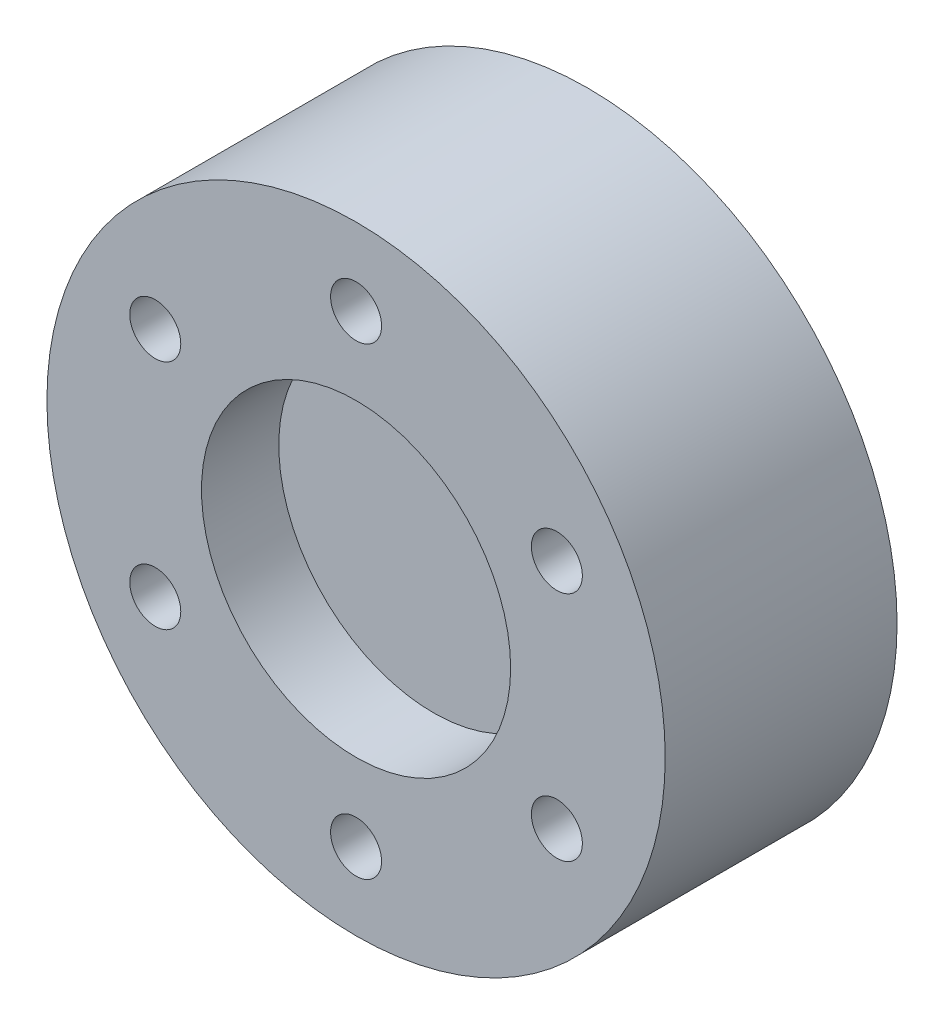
SolidWorks part; units mm, degrees
ref_plane "Front Plane" through (0, 0, 0) normal (0, 0, 1) x (1, 0, 0)
ref_plane "Top Plane" through (0, 0, 0) normal (0, 1, 0) x (1, 0, 0)
ref_plane "Right Plane" through (0, 0, 0) normal (1, 0, 0) x (0, 0, -1)
sketch "Sketch1" plane through (0, 0, 0) normal (0, 0, 1) x (1, 0, 0)
  circle A0 centre (0, 0) radius 20
  dimension "D1" = 40
extrude "Boss-Extrude1" add sketch "Sketch1" along normal blind 15
sketch "Sketch2" plane through (0, 0, 15) normal (0, 0, 1) x (1, 0, 0)
  circle A0 centre (0, 0) radius 10
  dimension "D1" = 20
extrude "Cut-Extrude1" cut sketch "Sketch2" against normal blind 5
hole_wizard "M4x0.7 Tapped Hole1" positions "Sketch3" profile "Sketch4" tap size "M4x0.7" standard "ANSI Metric"
sketch "Sketch3" plane through (0, 0, 15) normal (0, 0, 1) x (1, 0, 0)
  point P0 (0, 15)
  dimension "D1" = 15
sketch "Sketch4" plane through (0, 15, 15) normal (1, 0, 0) x (0, -1, 0)
  line L0 (0, 0) -> (0, 8.0914)
  line L1 (0, 8.0914) -> (1.65, 7.1)
  line L2 (1.65, 7.1) -> (1.65, 0)
  line L5 (1.65, 0) -> (0, 0)
  line L10 (0, 8.0914) -> (-1.65, 7.1) construction
  line L11 (0, -6.35) -> (0, 107.95) construction
  dimension "Tap Drill Dia." = 3.3
  dimension "Tap Drill Depth" = 7.1
  dimension "Drill Angle" = 118
pattern_circular "CirPattern1" count 6 over 360 about axis through (0, 0, 0) along (0, 0, 1) of "M4x0.7 Tapped Hole1"
sketch "Sketch5" plane through (0, 0, 0) normal (0, 0, -1) x (-1, 0, 0)
  circle A0 centre (0, 0) radius 17.5
  dimension "D1" = 35
extrude "Cut-Extrude2" cut sketch "Sketch5" against normal blind 3
